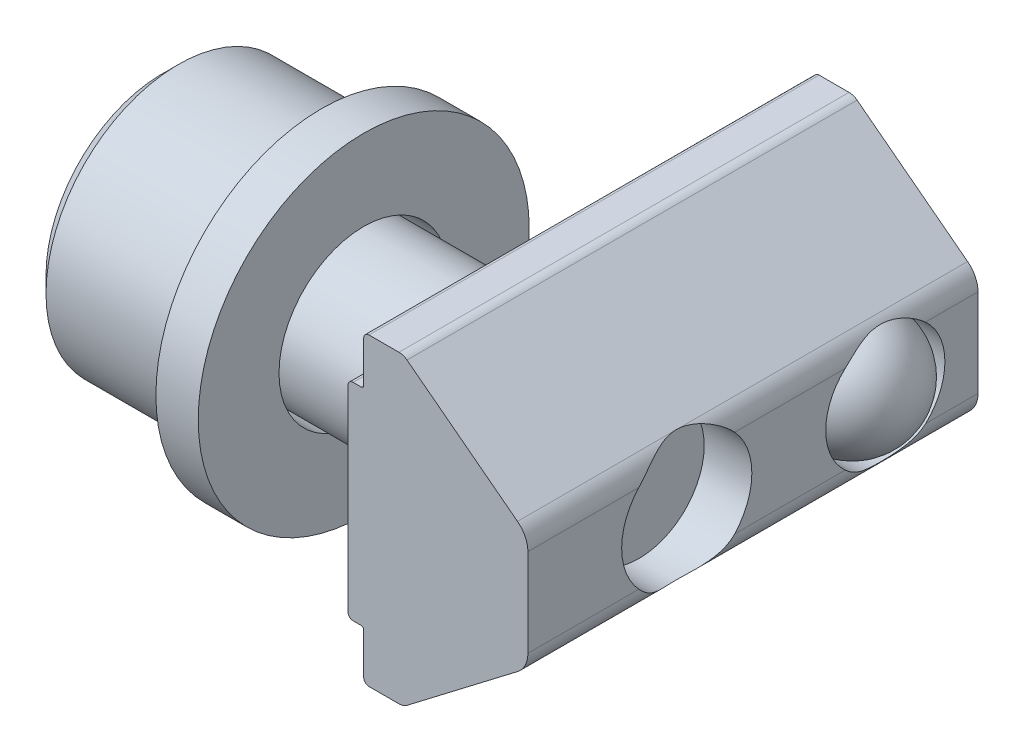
SolidWorks part; units mm, degrees
ref_plane "Front Plane" through (0, 0, 0) normal (0, 0, 1) x (1, 0, 0)
ref_plane "Top Plane" through (0, 0, 0) normal (0, 1, 0) x (1, 0, 0)
ref_plane "Right Plane" through (0, 0, 0) normal (1, 0, 0) x (0, 0, -1)
ref_plane "Plane1" through (3, 0, 0) normal (1, 0, 0) x (0, 0, -1)
sketch "Sketch1" plane through (0, 0, 0) normal (0, 0, 1) x (1, 0, 0)
  line L0 (-4.6, 2.5) -> (-3.1566, 0)
  line L1 (10.4, 0) -> (10.4, 3)
  line L2 (10.4, 3) -> (-1.6, 3)
  line L3 (-7.6, 4.4) -> (-7.6, 5) construction
  line L4 (-1.6, 5) -> (-7, 5)
  line L5 (-7, 5) -> (-7.6, 4.4)
  line L6 (-7.6, 4.4) -> (-7.6, 2.5)
  line L7 (-3.1566, 0) -> (10.4, 0) construction
  line L8 (-4.6, 2.5) -> (-7.6, 2.5)
  line L9 (-3.1566, 0) -> (10.4, 0)
  line L10 (-1.6, 5) -> (-1.6, -5) construction
  line L11 (-7, 5) -> (-7.6, 5) construction
  line L12 (9.4875, 0) -> (-9.4875, 0) construction
  line L13 (-1.6, 5) -> (-1.6, 3)
  line L14 (10.4, 3) -> (10.4, -3) construction
  line L15 (-3.1566, 0) -> (-4.6, -2.5) construction
  line L16 (0, -6.875) -> (0, 6.875) construction
  point P0 (-1.6, 0)
  dimension "FIX_1" = 12
  dimension "FIX_2" = 6
  dimension "FIX_3" = 10
  dimension "FIX_4" = 1.6
  dimension "FIX_5" = 3
  dimension "FIX_6" = 5
  dimension "FIX_7" = 120
  dimension "FIX_8" = 0.6
revolve "Revolve1" add sketch "Sketch1" angle 360 about L9
sketch "Sketch2" plane through (-7.6, 0, 0) normal (-1, 0, 0) x (0, 0, 1)
  line L1 (0, 2.8868) -> (-2.5, 1.4434)
  line L2 (-2.5, 1.4434) -> (-2.5, -1.4434)
  line L3 (-2.5, -1.4434) -> (0, -2.8868)
  line L4 (0, -2.8868) -> (2.5, -1.4434)
  line L5 (2.5, -1.4434) -> (2.5, 1.4434)
  line L6 (2.5, 1.4434) -> (0, 2.8868)
  circle A0 centre (0, 0) radius 2.5 construction
extrude "Cut-Extrude1" cut sketch "Sketch2" against normal up to vertex (3 mm away)
sketch "Sketch3" plane through (0, 0, 0) normal (1, 0, 0) x (0, 0, -1)
  circle A0 centre (0, 0) radius 6.25
  circle A1 centre (0, 0) radius 3.2
  dimension "FIX_10" = 6.4
  dimension "FIX_11" = 12.5
extrude "Boss-Extrude1" add sketch "Sketch3" against normal up to vertex (1.6 mm away) separate body
sketch "Sketch4" plane through (0, 0, 0) normal (0, 0, 1) x (1, 0, 0)
  line L0 (7.6344, 5.6472) -> (7.5, 5.75) construction
  line L1 (11.8074, 2.4567) -> (12.2, 2.1565) construction
  line L2 (12.2, 0) -> (0, 0) construction
  line L3 (7.3308, 5.75) -> (7.5, 5.75) construction
  line L4 (11.8074, -2.4567) -> (12.2, -2.1565) construction
  line L5 (12.2, 2.1565) -> (12.2, -2.1565) construction
  line L7 (3, -6.875) -> (3, 6.875) construction
  line L10 (12.2, -1.6623) -> (12.2, 1.6623)
  line L11 (11.8074, 2.4567) -> (7.6344, 5.6472)
  line L12 (7.3308, 5.75) -> (6.2, 5.75)
  line L13 (6, 5.55) -> (6, 4)
  line L14 (5.9, 3.9) -> (5.6, 3.9)
  line L15 (5.4, 3.7) -> (5.4, -3.7)
  line L16 (5.6, -3.9) -> (5.9, -3.9)
  line L17 (6, -4) -> (6, -5.55)
  line L18 (6.2, -5.75) -> (7.3308, -5.75)
  line L19 (7.6344, -5.6472) -> (11.8074, -2.4567)
  arc A6 (12.2, 1.6623) -> (11.8074, 2.4567) centre (11.2, 1.6623) ccw
  arc A7 (7.6344, 5.6472) -> (7.3308, 5.75) centre (7.3308, 5.25) ccw
  arc A8 (6.2, 5.75) -> (6, 5.55) centre (6.2, 5.55) ccw
  arc A9 (5.9, 3.9) -> (6, 4) centre (5.9, 4) ccw
  arc A10 (5.6, 3.9) -> (5.4, 3.7) centre (5.6, 3.7) ccw
  arc A11 (5.4, -3.7) -> (5.6, -3.9) centre (5.6, -3.7) ccw
  arc A12 (6, -4) -> (5.9, -3.9) centre (5.9, -4) ccw
  arc A13 (6, -5.55) -> (6.2, -5.75) centre (6.2, -5.55) ccw
  arc A14 (7.3308, -5.75) -> (7.6344, -5.6472) centre (7.3308, -5.25) ccw
  arc A15 (11.8074, -2.4567) -> (12.2, -1.6623) centre (11.2, -1.6623) ccw
  point P5 (5.4, 0)
  dimension "FIX_18" = 0.2
  dimension "FIX_19" = 0.1
  dimension "FIX_20" = 1
  dimension "FIX_21" = 0.5
  dimension "FIX_12" = 0.6
  dimension "FIX_13" = 6.2
  dimension "FIX_14" = 7.8
  dimension "FIX_15" = 11.5
  dimension "FIX_16" = 4.313
  dimension "FIX_17" = 1.5
  dimension "FIX_22" = 3
extrude "Boss-Extrude2" add sketch "Sketch4" along normal blind 6 and the other way blind 11 separate body
sketch "Sketch5" plane through (0, 0, -7.5) normal (0, 1, 0) x (1, 0, 0)
  line L0 (12.2, 2.25) -> (12.2, -2.25) construction
  line L2 (-6.875, -7.5) -> (6.875, -7.5) construction
  line L4 (12.2, 0) -> (10.95, 0)
  line L5 (12.2, 0) -> (12.2, 2.25)
  line L6 (12.2, 2.25) -> (10.95, 2.25)
  line L7 (10.95, 0) -> (10.95, 2.25)
  dimension "FIX_25" = 1.25
  dimension "FIX_27" = 7.5
  dimension "FIX_26" = 4.5
revolve "Cut-Revolve1" cut sketch "Sketch5" angle 360 about L4
sketch "Sketch6" plane through (0, 0, -7.5) normal (0, 1, 0) x (1, 0, 0)
  line L1 (10.95, -2.25) -> (10.95, 2.25) construction
  line L2 (10.95, 0) -> (10.95, 2.25)
  line L3 (10.95, 0) -> (13.2, 0)
  line L4 (10.95, 0) -> (10.95, 2.25) construction
  line L5 (10.95, 2.25) -> (13.2, 2.25) construction
  line L6 (13.2, 0) -> (13.2, 2.25) construction
  arc A0 (13.2, 0) -> (10.95, 2.25) centre (10.95, 0) ccw
  dimension "FIX_29" = 4.5
  dimension "FIX_30" = 2.25
revolve "Revolve2" add sketch "Sketch6" angle 360 about L3
hole_wizard "Tap1" positions "Sketch7" profile "Sketch8" hole size "M6x1.0" standard "JIS"
sketch "Sketch7" plane through (5.4, 0, 0) normal (-1, 0, 0) x (0, 0, 1)
  point P0 (0, 0)
sketch "Sketch8" plane through (5.4, 0, 0) normal (0, 1, 0) x (0, 0, 1)
  line L0 (0, 0) -> (0, 7.8)
  line L1 (0, 7.8) -> (2.4585, 7.8)
  line L2 (2.4585, 7.8) -> (2.4585, 0)
  line L5 (2.4585, 0) -> (0, 0)
  line L11 (0, 0) -> (0, 7.8) construction
  dimension "Thru Hole Depth" = 7.8
equation "\"Factor\"= 1.082532"
equation "\"M\"= 6"
equation "\"Pitch\"= 1"
equation "\"HSD_1\"= round ( \"M\" - \"Factor\" * \"Pitch\" , 3 )"
equation "\"HTD_1\"= \"M\""
equation "\"ASD_1\"= \"M\""
equation "\"ATD_1\"= round ( \"M\" - \"Factor\" * \"Pitch\" , 3 )"
